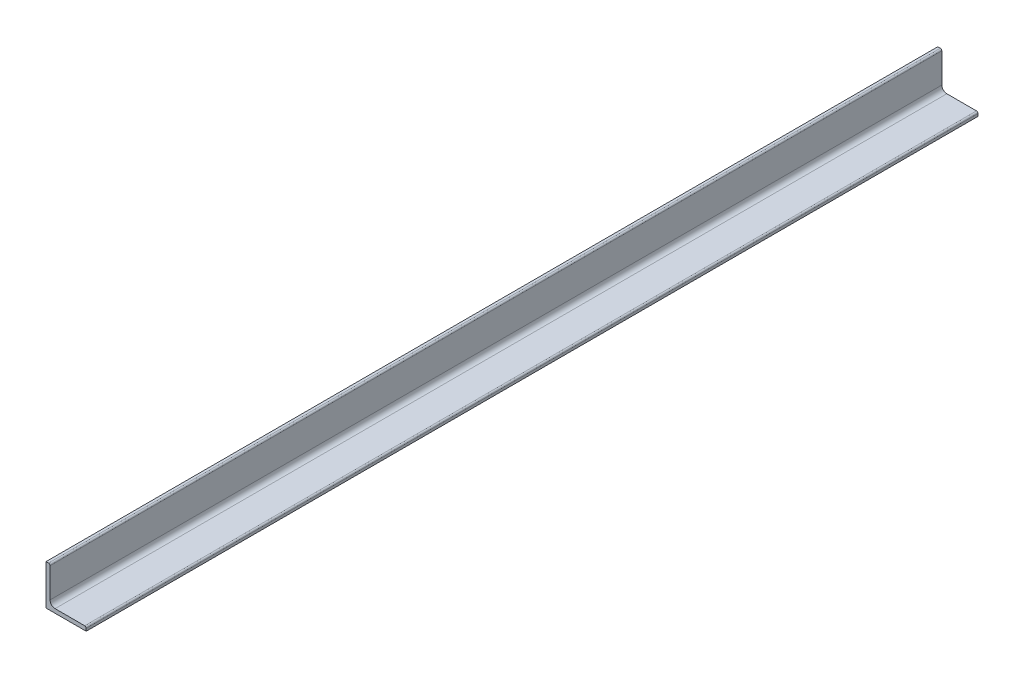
SolidWorks part; units mm, degrees
ref_plane "前视基准面" through (0, 0, 0) normal (0, 0, 1) x (1, 0, 0)
ref_plane "上视基准面" through (0, 0, 0) normal (0, 1, 0) x (1, 0, 0)
ref_plane "右视基准面" through (0, 0, 0) normal (1, 0, 0) x (0, 0, -1)
sketch "草图1" plane through (0, 0, 0) normal (0, 0, 1) x (1, 0, 0)
  line L0 (0, 40) -> (0, 0)
  line L1 (0, 0) -> (40, 0)
  line L2 (40, 0) -> (40, 2.5)
  line L3 (38.5, 4) -> (9, 4)
  line L4 (4, 9) -> (4, 38.5)
  line L5 (2.5, 40) -> (0, 40)
  arc A0 (9, 4) -> (4, 9) centre (9, 9) cw
  arc A1 (4, 38.5) -> (2.5, 40) centre (2.5, 38.5) ccw
  arc A2 (40, 2.5) -> (38.5, 4) centre (38.5, 2.5) ccw
  point P11 (4, 40)
  point P14 (40, 4)
  dimension "D5" = 5
  dimension "D6" = 1.5
  dimension "D1" = 40
  dimension "D2" = 40
  dimension "D3" = 4
  dimension "D4" = 4
extrude "拉伸1" add sketch "草图1" along normal mid plane 887
